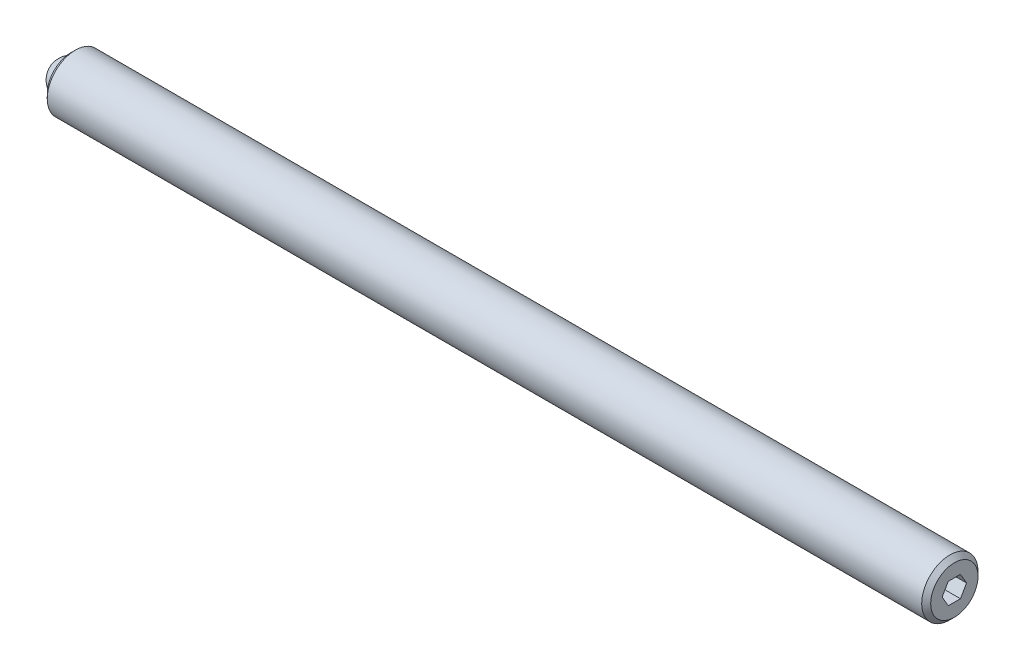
SolidWorks part; units mm, degrees
ref_plane "Front Plane" through (0, 0, 0) normal (0, 0, 1) x (1, 0, 0)
ref_plane "Top Plane" through (0, 0, 0) normal (0, 1, 0) x (1, 0, 0)
ref_plane "Right Plane" through (0, 0, 0) normal (1, 0, 0) x (0, 0, -1)
sketch "Sketch2" plane through (0, 0, 0) normal (1, 0, 0) x (0, 0, -1)
  circle A0 centre (0, 0) radius 3.175
  dimension "D1" = 6.35
extrude "Boss-Extrude1" add sketch "Sketch2" along normal blind 99.6156
sketch "Sketch3" plane through (0, 0, 0) normal (-1, 0, 0) x (0, 0, 1)
  circle A0 centre (0, 0) radius 1.9812
  dimension "D1" = 3.9624
chamfer "Chamfer1" distance 0.508 angle 45 1 edges at (0, 0, -3.175)
chamfer "Chamfer2" distance 0.508 angle 45 1 edges at (99.6156, 0, -3.175)
sketch "Sketch4" plane through (99.6156, 0, 0) normal (1, 0, 0) x (0, 0, -1)
  line L1 (1.3748, 0) -> (0.6874, 1.1906)
  line L2 (0.6874, 1.1906) -> (-0.6874, 1.1906)
  line L3 (-0.6874, 1.1906) -> (-1.3748, 0)
  line L4 (-1.3748, 0) -> (-0.6874, -1.1906)
  line L5 (-0.6874, -1.1906) -> (0.6874, -1.1906)
  line L6 (0.6874, -1.1906) -> (1.3748, 0)
  circle A0 centre (0, 0) radius 1.1906 construction
  dimension "D1" = 2.3813
extrude "Cut-Extrude2" cut sketch "Sketch4" against normal blind 2.286
extrude "Cut-Extrude3" cut sketch "Sketch3" against normal blind 1.9844
sketch "Sketch5" plane through (0, 0, 0) normal (-1, 0, 0) x (0, 0, 1)
  line L0 (0, 0) -> (0, -1.9844)
  line L1 (0, 0) -> (0, 1.9844)
  arc A0 (0, 1.9844) -> (0, -1.9844) centre (0, 0) ccw
  dimension "D1" = 1.9844
revolve "Revolve1" add sketch "Sketch5" angle 360 about L1
